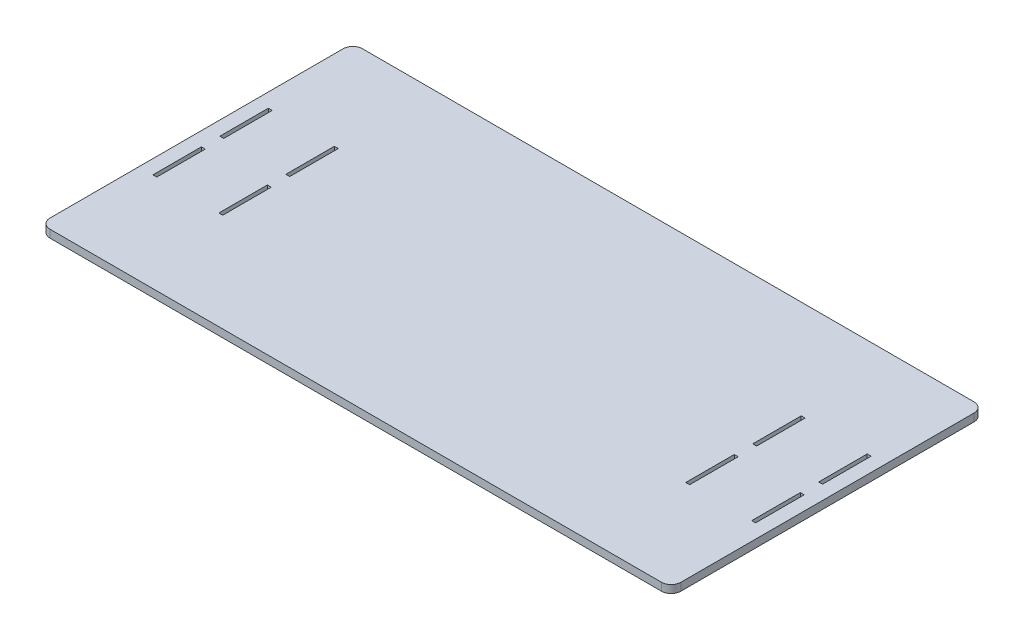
SolidWorks part; units mm, degrees
ref_plane "Front" through (0, 0, 0) normal (0, 0, 1) x (1, 0, 0)
ref_plane "Top" through (0, 0, 0) normal (0, 1, 0) x (1, 0, 0)
ref_plane "Right" through (0, 0, 0) normal (1, 0, 0) x (0, 0, -1)
sketch "Sketch1" plane through (0, 0, 0) normal (0, 1, 0) x (1, 0, 0)
  line L0 (0, 161) -> (0, -161) construction
  line L1 (-315, 161) -> (315, 161)
  line L2 (-325, 151) -> (-325, -151)
  line L3 (-315, -161) -> (315, -161)
  line L4 (325, 151) -> (325, -151)
  line L5 (-325, 161) -> (325, -161) construction
  line L6 (-325, -161) -> (325, 161) construction
  line L7 (-325, 0) -> (325, 0) construction
  line L8 (-310.5, 161) -> (-310.5, -161) construction
  line L9 (-325, 9.5) -> (325, 9.5) construction
  line L10 (310.5, 161) -> (310.5, -161) construction
  line L11 (-325, -9.5) -> (325, -9.5) construction
  line L12 (-274.5, 161) -> (-274.5, -161) construction
  line L13 (-310.5, 9.5) -> (-306.5, 9.5)
  line L14 (-310.5, 9.5) -> (-310.5, 59.5)
  line L15 (-310.5, 59.5) -> (-306.5, 59.5)
  line L16 (-306.5, 9.5) -> (-306.5, 59.5)
  line L17 (-242.5, 9.5) -> (-242.5, 59.5)
  line L18 (-238.5, 59.5) -> (-242.5, 59.5)
  line L19 (-238.5, 9.5) -> (-238.5, 59.5)
  line L20 (-238.5, 9.5) -> (-242.5, 9.5)
  line L21 (-238.5, -9.5) -> (-242.5, -9.5)
  line L22 (-238.5, -9.5) -> (-238.5, -59.5)
  line L23 (-238.5, -59.5) -> (-242.5, -59.5)
  line L24 (-242.5, -9.5) -> (-242.5, -59.5)
  line L25 (-306.5, -9.5) -> (-306.5, -59.5)
  line L26 (-310.5, -59.5) -> (-306.5, -59.5)
  line L27 (-310.5, -9.5) -> (-310.5, -59.5)
  line L28 (-310.5, -9.5) -> (-306.5, -9.5)
  line L29 (310.5, -9.5) -> (306.5, -9.5)
  line L30 (310.5, -9.5) -> (310.5, -59.5)
  line L31 (310.5, -59.5) -> (306.5, -59.5)
  line L32 (306.5, -9.5) -> (306.5, -59.5)
  line L33 (242.5, -9.5) -> (242.5, -59.5)
  line L34 (238.5, -59.5) -> (242.5, -59.5)
  line L35 (238.5, -9.5) -> (238.5, -59.5)
  line L36 (238.5, -9.5) -> (242.5, -9.5)
  line L37 (238.5, 9.5) -> (242.5, 9.5)
  line L38 (238.5, 9.5) -> (238.5, 59.5)
  line L39 (238.5, 59.5) -> (242.5, 59.5)
  line L40 (242.5, 9.5) -> (242.5, 59.5)
  line L41 (306.5, 9.5) -> (306.5, 59.5)
  line L42 (310.5, 59.5) -> (306.5, 59.5)
  line L43 (310.5, 9.5) -> (310.5, 59.5)
  line L44 (310.5, 9.5) -> (306.5, 9.5)
  arc A0 (-325, -151) -> (-315, -161) centre (-315, -151) ccw
  arc A1 (315, -161) -> (325, -151) centre (315, -151) ccw
  arc A2 (315, 161) -> (325, 151) centre (315, 151) cw
  arc A3 (-315, 161) -> (-325, 151) centre (-315, 151) ccw
  point P0 (0, 0)
  point P64 (-238.5, 34.5)
  point P65 (238.5, 34.5)
  point P66 (-238.5, -34.5)
  point P67 (238.5, -34.5)
  dimension "D8" = 10
  dimension "D1" = 650
  dimension "D2" = 322
  dimension "D3" = 14.5
  dimension "D4" = 9.5
  dimension "D5" = 4
  dimension "D6" = 50
  dimension "D7" = 32
  dimension "D9" = 477
  dimension "D10" = 477
  dimension "D11" = 238.5
extrude "Boss-Extrude1" add sketch "Sketch1" along normal blind 8
